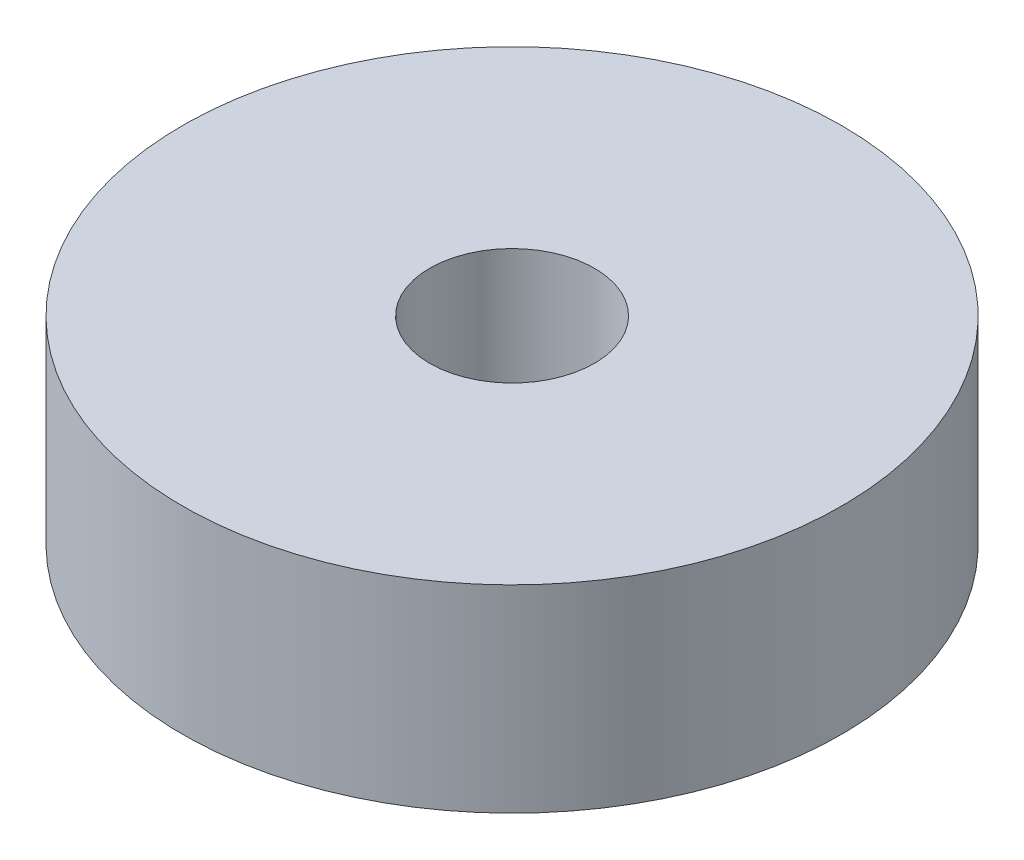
SolidWorks part; units mm, degrees
ref_plane "Front Plane" through (0, 0, 0) normal (0, 0, 1) x (1, 0, 0)
ref_plane "Top Plane" through (0, 0, 0) normal (0, 1, 0) x (1, 0, 0)
ref_plane "Right Plane" through (0, 0, 0) normal (1, 0, 0) x (0, 0, -1)
sketch "Sketch1" plane through (0, 0, 0) normal (0, 1, 0) x (1, 0, 0)
  circle A0 centre (0, 0) radius 12.7
  dimension "D1" = 25.4
extrude "Boss-Extrude1" add sketch "Sketch1" along normal blind 7.62
sketch "Sketch2" plane through (0, 7.62, 0) normal (0, 1, 0) x (1, 0, 0)
  circle A0 centre (0, 0) radius 3.175
  dimension "D1" = 6.35
extrude "Cut-Extrude1" cut sketch "Sketch2" against normal blind 7.62
sketch "Sketch3" plane through (0, 0, 0) normal (0, -1, 0) x (1, 0, 0)
  circle A0 centre (0, 0) radius 5.715
  circle A1 centre (0, 0) radius 10.16
  circle A2 centre (0, 0) radius 12.7 construction
  circle A3 centre (0, 0) radius 3.175 construction
  dimension "D1" = 2.54
  dimension "D2" = 2.54
extrude "Cut-Extrude2" cut sketch "Sketch3" against normal blind 5.08
fillet "Fillet1" radius 2.032 2 edges at (0, 5.08, -5.715) (0, 5.08, -10.16)
